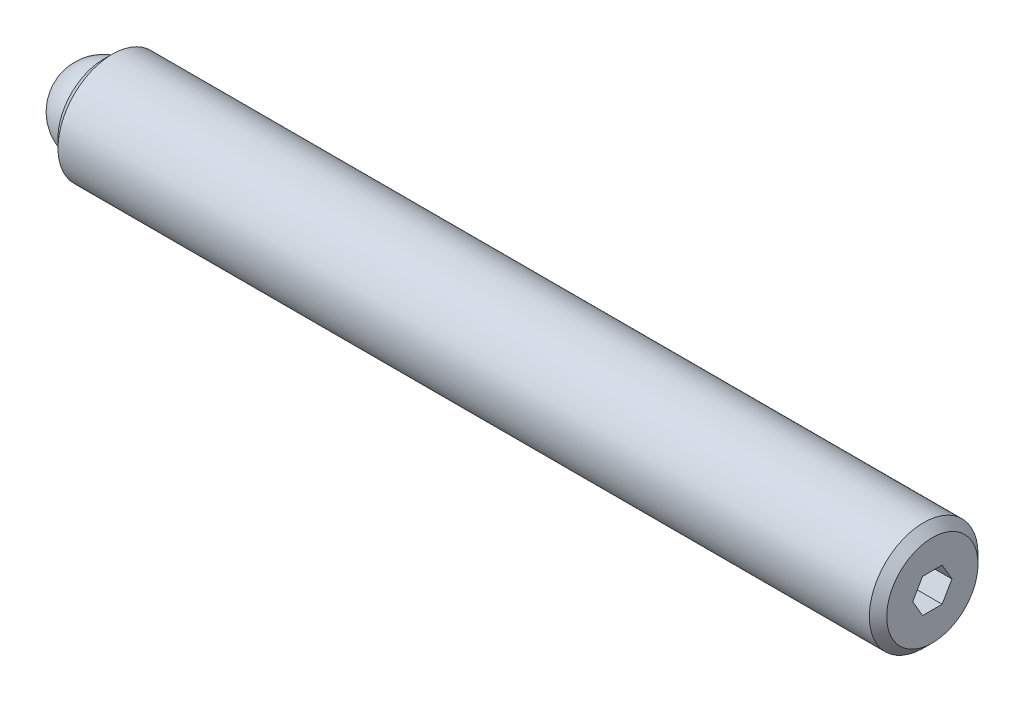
SolidWorks part; units mm, degrees
ref_plane "Front Plane" through (0, 0, 0) normal (0, 0, 1) x (1, 0, 0)
ref_plane "Top Plane" through (0, 0, 0) normal (0, 1, 0) x (1, 0, 0)
ref_plane "Right Plane" through (0, 0, 0) normal (1, 0, 0) x (0, 0, -1)
sketch "Sketch2" plane through (0, 0, 0) normal (1, 0, 0) x (0, 0, -1)
  circle A0 centre (0, 0) radius 3.175
  dimension "D1" = 6.35
extrude "Boss-Extrude1" add sketch "Sketch2" along normal blind 48.4187
sketch "Sketch3" plane through (0, 0, 0) normal (-1, 0, 0) x (0, 0, 1)
  circle A0 centre (0, 0) radius 2.3813
  dimension "D1" = 4.7625
chamfer "Chamfer1" distance 0.508 angle 45 1 edges at (0, 0, -3.175)
chamfer "Chamfer2" distance 0.508 angle 45 1 edges at (48.4187, 0, -3.175)
sketch "Sketch4" plane through (48.4187, 0, 0) normal (1, 0, 0) x (0, 0, -1)
  line L1 (1.1457, 0) -> (0.5728, 0.9922)
  line L2 (0.5728, 0.9922) -> (-0.5728, 0.9922)
  line L3 (-0.5728, 0.9922) -> (-1.1457, 0)
  line L4 (-1.1457, 0) -> (-0.5728, -0.9922)
  line L5 (-0.5728, -0.9922) -> (0.5728, -0.9922)
  line L6 (0.5728, -0.9922) -> (1.1457, 0)
  circle A0 centre (0, 0) radius 0.9922 construction
  dimension "D1" = 1.9844
extrude "Cut-Extrude2" cut sketch "Sketch4" against normal blind 2.286
extrude "Cut-Extrude3" cut sketch "Sketch3" against normal blind 2.3813
sketch "Sketch5" plane through (0, 0, 0) normal (-1, 0, 0) x (0, 0, 1)
  line L0 (0, 0) -> (0, -2.3813)
  line L1 (0, 0) -> (0, 2.3813)
  arc A0 (0, 2.3813) -> (0, -2.3813) centre (0, 0) ccw
  dimension "D1" = 2.3813
revolve "Revolve1" add sketch "Sketch5" angle 360 about L1
sketch "Sketch7" plane through (0, 0, 0) normal (-1, 0, 0) x (0, 0, 1)
  line L0 (0, 0) -> (0, 2.3813) construction
  circle A0 centre (0, 0) radius 2.3813 construction
  arc A1 (0.0635, 2.3804) -> (-0.0635, 2.3804) centre (0, 0) ccw
  arc A2 (0.0635, 2.3804) -> (-0.0635, 2.3804) centre (0, 2.3813) ccw
  dimension "D1" = 0.127
extrude "Cut-Extrude4" cut sketch "Sketch7" against normal up to surface (2.3813 mm away) contours A2 A1
